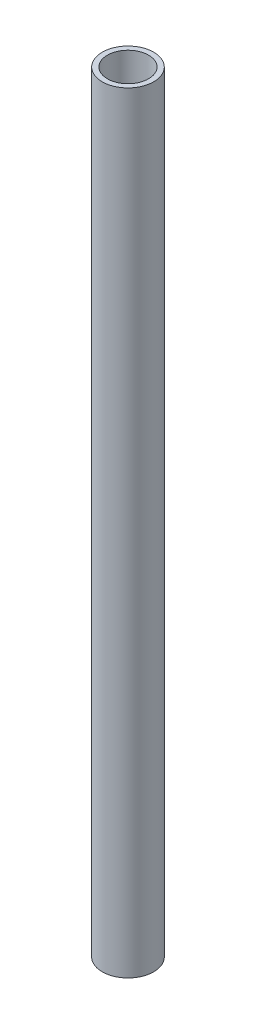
SolidWorks part; units mm, degrees
ref_plane "Front Plane" through (0, 0, 0) normal (0, 0, 1) x (1, 0, 0)
ref_plane "Top Plane" through (0, 0, 0) normal (0, 1, 0) x (1, 0, 0)
ref_plane "Right Plane" through (0, 0, 0) normal (1, 0, 0) x (0, 0, -1)
sketch "Sketch1" plane through (0, 0, 0) normal (0, 1, 0) x (1, 0, 0)
  circle A0 centre (0, 0) radius 5
  circle A1 centre (0, 0) radius 4
  dimension "D1" = 10
  dimension "D2" = 1
extrude "Boss-Extrude1" add sketch "Sketch1" along normal blind 150
